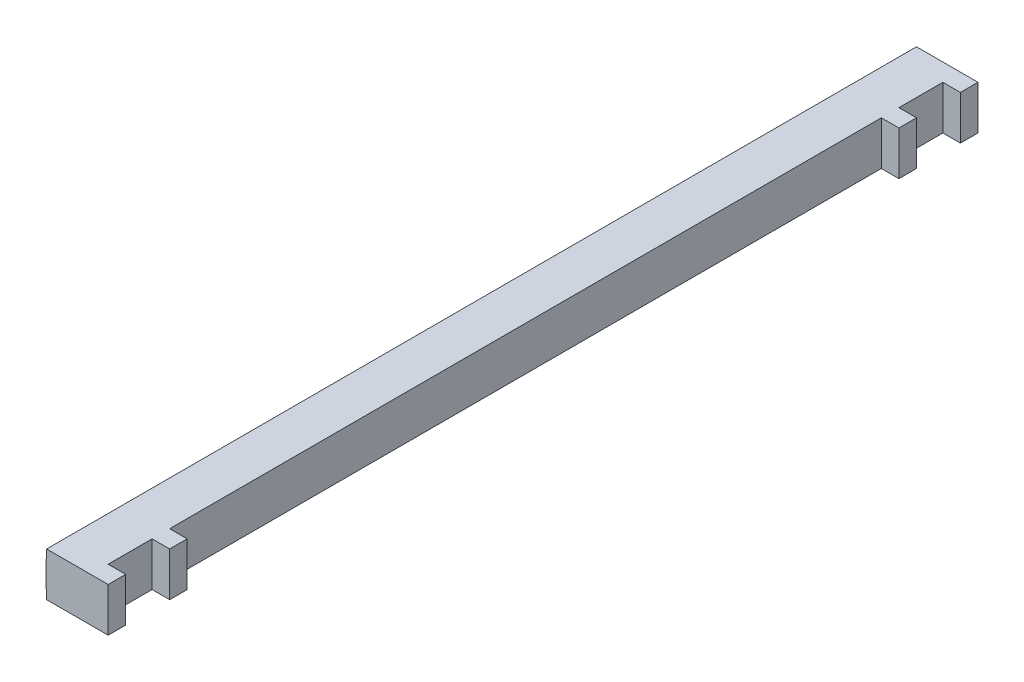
SolidWorks part; units mm, degrees
ref_plane "Front Plane" through (0, 0, 0) normal (0, 0, 1) x (1, 0, 0)
ref_plane "Top Plane" through (0, 0, 0) normal (0, 1, 0) x (1, 0, 0)
ref_plane "Right Plane" through (0, 0, 0) normal (1, 0, 0) x (0, 0, -1)
sketch "Sketch1" plane through (0, 0, 0) normal (0, 0, 1) x (1, 0, 0)
  line L0 (-47.519, 3.175) -> (-41.169, 3.175)
  line L1 (-41.169, 3.175) -> (-41.169, -3.175)
  line L2 (-41.169, -3.175) -> (-47.519, -3.175)
  arc A4 (-47.519, 3.175) -> (-47.519, -3.175) centre (0, 0) ccw
  dimension "D1" = 6.35
  dimension "D2" = 6.35
  dimension "D3" = 47.625
extrude "Boss-Extrude1" add sketch "Sketch1" along normal blind 173.99
sketch "Sketch2" plane through (-41.169, 0, 0) normal (1, 0, 0) x (0, 0, -1)
  line L0 (-173.99, 3.175) -> (0, 3.175) construction
  line L1 (-125.73, -3.175) -> (-123.19, -3.175)
  line L2 (-125.73, -3.175) -> (-125.73, 3.175)
  line L3 (-125.73, 3.175) -> (-123.19, 3.175)
  line L4 (-123.19, -3.175) -> (-123.19, 3.175)
  line L6 (-173.99, -3.175) -> (0, -3.175) construction
  line L8 (-116.84, 3.175) -> (-114.3, 3.175)
  line L9 (-116.84, 3.175) -> (-116.84, -3.175)
  line L10 (-116.84, -3.175) -> (-114.3, -3.175)
  line L11 (-114.3, 3.175) -> (-114.3, -3.175)
  line L19 (-11.43, -3.175) -> (-11.43, 3.175)
  line L20 (-11.43, -3.175) -> (-8.89, -3.175)
  line L21 (-8.89, -3.175) -> (-8.89, 3.175)
  line L22 (-11.43, 3.175) -> (-8.89, 3.175)
  line L23 (-2.54, 3.175) -> (-2.54, -3.175)
  line L24 (-2.54, 3.175) -> (0, 3.175)
  line L25 (0, 3.175) -> (0, -3.175)
  line L26 (-2.54, -3.175) -> (0, -3.175)
  line L35 (-173.99, -3.175) -> (-173.99, 3.175) construction
  dimension "D1" = 50.8
  dimension "D2" = 2.54
  dimension "D3" = 6.35
  dimension "D5" = 6.35
  dimension "D4" = 107.95
extrude "Boss-Extrude2" add sketch "Sketch2" along normal blind 2.54
sketch "Sketch3" plane through (0, -3.175, 0) normal (0, -1, 0) x (-1, 0, 0)
  line L0 (38.629, -125.73) -> (41.169, -125.73) construction
  line L5 (37.1634, -176.7133) -> (59.147, -176.7133)
  line L6 (37.1634, -176.7133) -> (37.1634, -125.73)
  line L7 (37.1634, -125.73) -> (59.147, -125.73)
  line L8 (59.147, -176.7133) -> (59.147, -125.73)
extrude "Cut-Extrude1" cut sketch "Sketch3" against normal blind 42.672
